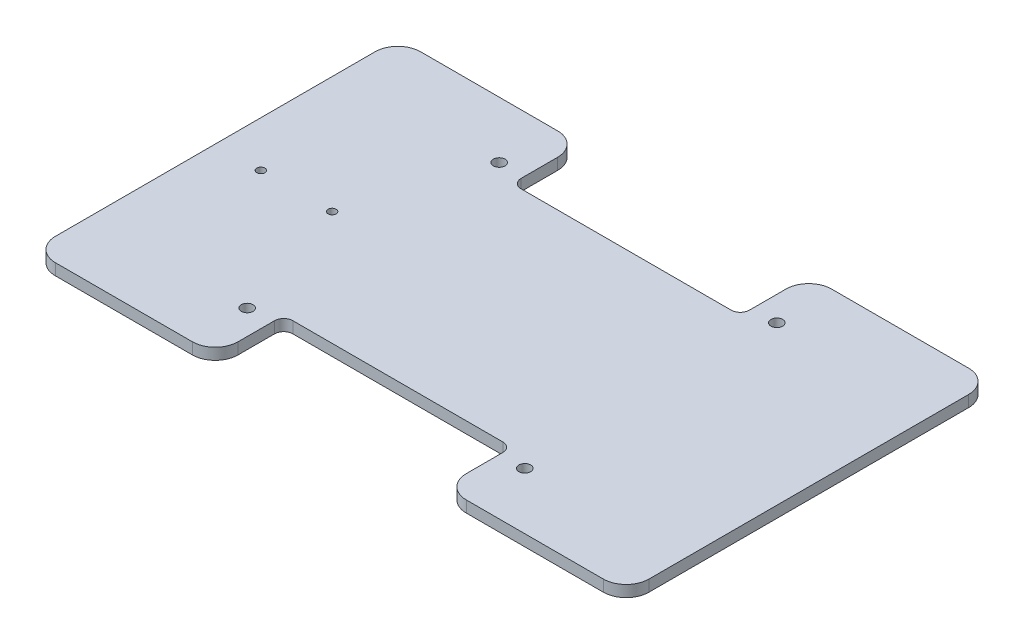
SolidWorks part; units mm, degrees
ref_plane "Front Plane" through (0, 0, 0) normal (0, 0, 1) x (1, 0, 0)
ref_plane "Top Plane" through (0, 0, 0) normal (0, 1, 0) x (1, 0, 0)
ref_plane "Right Plane" through (0, 0, 0) normal (1, 0, 0) x (0, 0, -1)
sketch "Sketch1" plane through (0, 0, 0) normal (0, 1, 0) x (1, 0, 0)
  line L1 (-82.55, -50.8) -> (82.55, -50.8)
  line L2 (-82.55, -50.8) -> (-82.55, 50.8)
  line L3 (-82.55, 50.8) -> (82.55, 50.8)
  line L4 (82.55, -50.8) -> (82.55, 50.8)
  line L5 (-82.55, -50.8) -> (82.55, 50.8) construction
  line L6 (-82.55, 50.8) -> (82.55, -50.8) construction
  point P0 (0, 0)
  dimension "D1" = 101.6
  dimension "D2" = 165.1
extrude "Boss-Extrude1" add sketch "Sketch1" along normal blind 3.175
fillet "Fillet1" radius 6.35 4 edges at (-82.55, 1.5875, -50.8) (82.55, 1.5875, -50.8) (-82.55, 1.5875, 50.8) (82.55, 1.5875, 50.8)
hole_wizard "#4 Clearance Hole1" positions "Sketch3" profile "Sketch2" hole size "#4" standard "ANSI Inch"
sketch "Sketch3" plane through (0, 3.175, 0) normal (0, 1, 0) x (1, 0, 0)
  point P0 (-38.608, 35.052)
  point P3 (38.608, 35.052)
  point P6 (38.608, -35.052)
  point P9 (-38.608, -35.052)
sketch "Sketch2" plane through (-38.608, 3.175, -35.052) normal (1, 0, 0) x (0, 0, 1)
  line L0 (0, 0) -> (0, 3.175)
  line L1 (0, 3.175) -> (1.6319, 3.175)
  line L2 (1.6319, 3.175) -> (1.6319, 0)
  line L5 (1.6319, 0) -> (0, 0)
  line L11 (0, -6.35) -> (0, 107.95) construction
  dimension "Thru Hole Dia." = 3.2639
  dimension "Thru Hole Depth" = 3.175
ref_plane "Plane1" through (-76.2, 3.175, -50.8) normal (-1, 0, 0) x (0, 0, 1)
sketch "Sketch5" plane through (0, 3.175, 0) normal (0, 1, 0) x (1, 0, 0)
  line L0 (-31.75, 34.29) -> (-31.75, 44.45) construction
  line L1 (29.21, 31.75) -> (-29.21, 31.75) construction
  line L2 (31.75, 34.29) -> (31.75, 44.45) construction
  line L3 (-31.75, -34.29) -> (-31.75, -44.45) construction
  line L4 (29.21, -31.75) -> (-29.21, -31.75) construction
  line L5 (31.75, -34.29) -> (31.75, -44.45) construction
  line L6 (-31.75, 34.29) -> (-31.75, 44.45)
  line L7 (29.21, 31.75) -> (-29.21, 31.75)
  line L8 (31.75, 34.29) -> (31.75, 44.45)
  line L9 (-31.75, -34.29) -> (-31.75, -44.45)
  line L10 (29.21, -31.75) -> (-29.21, -31.75)
  line L11 (31.75, -34.29) -> (31.75, -44.45)
  line L12 (-38.1, -50.8) -> (38.1, -50.8)
  line L13 (-38.1, 50.8) -> (38.1, 50.8)
  arc A0 (-31.75, 44.45) -> (-38.1, 50.8) centre (-38.1, 44.45) ccw construction
  arc A1 (-31.75, 34.29) -> (-29.21, 31.75) centre (-29.21, 34.29) ccw construction
  arc A2 (29.21, 31.75) -> (31.75, 34.29) centre (29.21, 34.29) ccw construction
  arc A3 (38.1, 50.8) -> (31.75, 44.45) centre (38.1, 44.45) ccw construction
  arc A4 (-38.1, -50.8) -> (-31.75, -44.45) centre (-38.1, -44.45) ccw construction
  arc A5 (-29.21, -31.75) -> (-31.75, -34.29) centre (-29.21, -34.29) ccw construction
  arc A6 (31.75, -34.29) -> (29.21, -31.75) centre (29.21, -34.29) ccw construction
  arc A7 (31.75, -44.45) -> (38.1, -50.8) centre (38.1, -44.45) ccw construction
  arc A8 (-31.75, 44.45) -> (-38.1, 50.8) centre (-38.1, 44.45) ccw
  arc A9 (-31.75, 34.29) -> (-29.21, 31.75) centre (-29.21, 34.29) ccw
  arc A10 (29.21, 31.75) -> (31.75, 34.29) centre (29.21, 34.29) ccw
  arc A11 (38.1, 50.8) -> (31.75, 44.45) centre (38.1, 44.45) ccw
  arc A12 (-38.1, -50.8) -> (-31.75, -44.45) centre (-38.1, -44.45) ccw
  arc A13 (-29.21, -31.75) -> (-31.75, -34.29) centre (-29.21, -34.29) ccw
  arc A14 (31.75, -34.29) -> (29.21, -31.75) centre (29.21, -34.29) ccw
  arc A15 (31.75, -44.45) -> (38.1, -50.8) centre (38.1, -44.45) ccw
extrude "Cut-Extrude1" cut sketch "Sketch5" against normal through all
hole_wizard "#4-40 Tapped Hole1" positions "Sketch7" profile "Sketch6" tap size "#4-40" standard "ANSI Inch"
sketch "Sketch7" plane through (0, 3.175, 0) normal (0, 1, 0) x (1, 0, 0)
  line L0 (-82.55, 44.45) -> (-82.55, -44.45) construction
  line L1 (-82.55, 0) -> (82.55, 0) construction
  line L2 (82.55, -44.45) -> (82.55, 44.45) construction
  point P0 (-69.85, 0)
  point P2 (-50.038, 0)
  point P5 (-82.55, 0)
  dimension "D1" = 19.812
  dimension "D2" = 12.7
sketch "Sketch6" plane through (-69.85, 3.175, 0) normal (1, 0, 0) x (0, 0, 1)
  line L0 (0, 0) -> (0, 3.175)
  line L1 (0, 3.175) -> (1.1303, 3.175)
  line L2 (1.1303, 3.175) -> (1.1303, 0)
  line L5 (1.1303, 0) -> (0, 0)
  line L11 (0, -6.35) -> (0, 107.95) construction
  dimension "Thread Major Dia." = 2.2606
  dimension "Thru Tap Drill Depth" = 3.175
